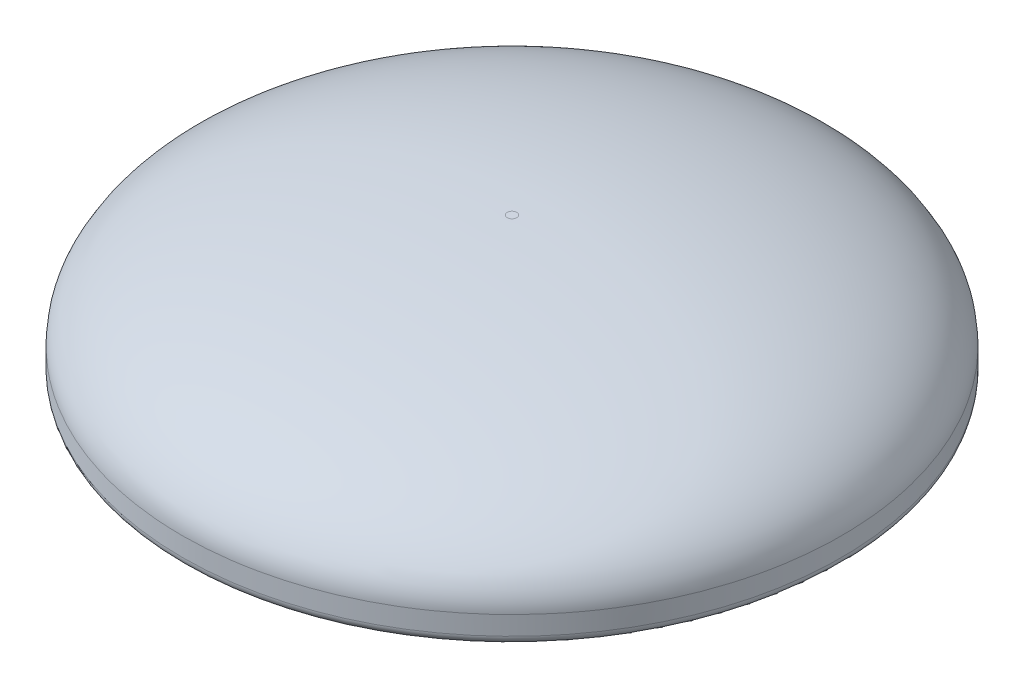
SolidWorks part; units mm, degrees
ref_plane "Front Plane" through (0, 0, 0) normal (0, 0, 1) x (1, 0, 0)
ref_plane "Top Plane" through (0, 0, 0) normal (0, 1, 0) x (1, 0, 0)
ref_plane "Right Plane" through (0, 0, 0) normal (1, 0, 0) x (0, 0, -1)
sketch "Sketch1" plane through (0, 0, 0) normal (0, 1, 0) x (1, 0, 0)
  circle A0 centre (0, 0) radius 35
extrude "Boss-Extrude1" add sketch "Sketch1" along normal blind 15
fillet "Fillet4" radius 1 1 edges at (0, 0, 35)
fillet "Fillet5" radius 12 1 edges at (0, 15, 35)
